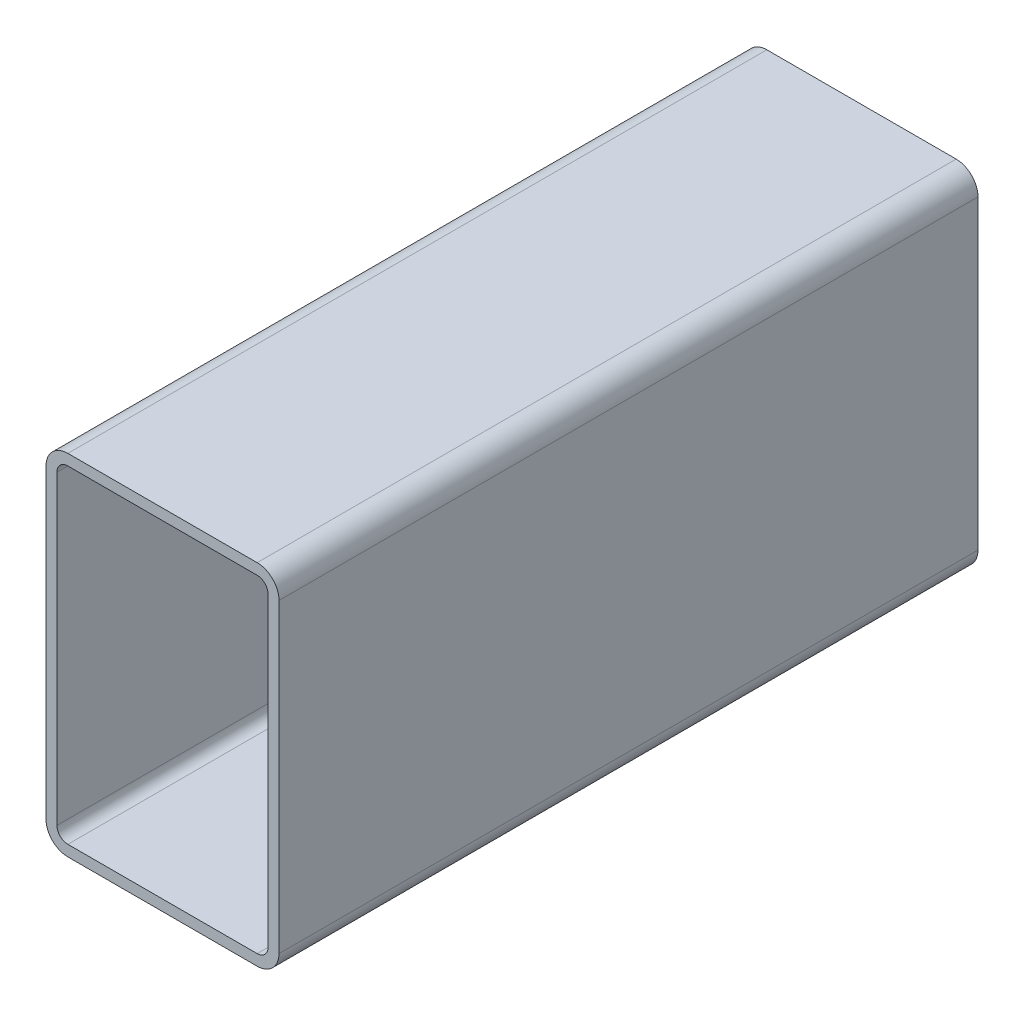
SolidWorks part; units mm, degrees
ref_plane "Front Plane" through (0, 0, 0) normal (0, 0, 1) x (1, 0, 0)
ref_plane "Top Plane" through (0, 0, 0) normal (0, 1, 0) x (1, 0, 0)
ref_plane "Right Plane" through (0, 0, 0) normal (1, 0, 0) x (0, 0, -1)
sketch "Sketch1" plane through (0, 0, 0) normal (0, 0, 1) x (1, 0, 0)
sketch_block_instance "HSS6x4x0.1875-1"
sketch_block "HSS6x4x0.1875"
extrude "Boss-Extrude1" add sketch "Sketch1" along normal blind 304.8
